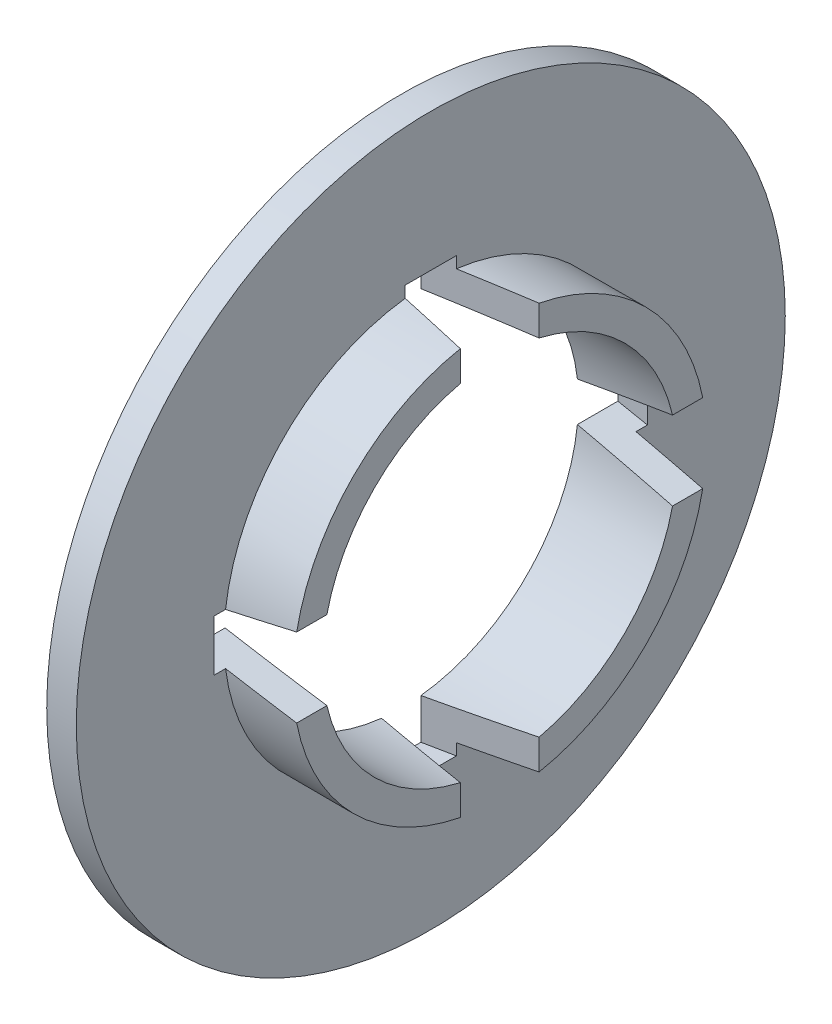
SolidWorks part; units mm, degrees
ref_plane "Plan de face" through (0, 0, 0) normal (0, 0, 1) x (1, 0, 0)
ref_plane "Plan de dessus" through (0, 0, 0) normal (0, 1, 0) x (1, 0, 0)
ref_plane "Plan de droite" through (0, 0, 0) normal (1, 0, 0) x (0, 0, -1)
sketch "Esquisse1" plane through (0, 0, 0) normal (0, 0, 1) x (1, 0, 0)
  line L0 (-80.2996, 0) -> (99.617, 0) construction
  line L1 (0, 18) -> (0, 9)
  line L2 (0, 9) -> (5, 9)
  line L3 (0, 18) -> (1.5, 18)
  line L4 (1.5, 18) -> (1.5, 10.5)
  line L5 (1.5, 10.5) -> (5, 10.5)
  line L6 (5, 10.5) -> (5, 9)
  dimension "D1" = 18
  dimension "D2" = 9
  dimension "D3" = 1.5
  dimension "D4" = 1.5
  dimension "D5" = 5
revolve "Révolution1" add sketch "Esquisse1" angle 360 about L0
ref_plane "Plan1" through (0, 7, 0) normal (0, 1, 0) x (-1, 0, 0)
sketch "Esquisse2" plane through (0, 7, 0) normal (0, 1, 0) x (-1, 0, 0)
  line L0 (-21.6771, 0) -> (13.3427, 0) construction
  line L1 (-5, -2) -> (-5, 2)
  line L2 (-5, 10.5) -> (-5, -10.5) construction
  line L3 (-5, 2) -> (0, 1)
  line L4 (0, -18) -> (0, 18) construction
  line L5 (0, 1) -> (0, -1)
  line L6 (-5, -2) -> (0, -1)
  point P12 (0, 0)
  point P13 (-5, 0)
  dimension "D1" = 2
  dimension "D2" = 1
extrude "Enlèv. mat.-Extru.2" cut sketch "Esquisse2" along normal blind 4
pattern_circular "Répétition circulaire1" count 4 every 90 about axis through (0, 0, 0) along (1, 0, 0) of "Enlèv. mat.-Extru.2"
